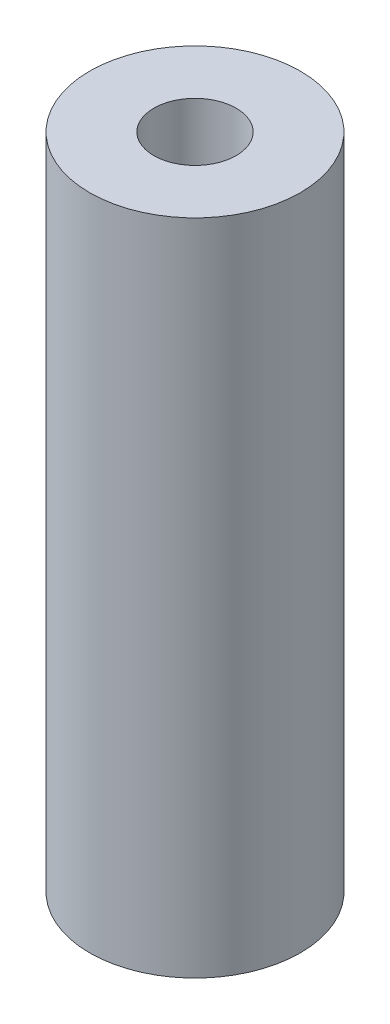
SolidWorks part; units mm, degrees
ref_plane "Front Plane" through (0, 0, 0) normal (0, 0, 1) x (1, 0, 0)
ref_plane "Top Plane" through (0, 0, 0) normal (0, 1, 0) x (1, 0, 0)
ref_plane "Right Plane" through (0, 0, 0) normal (1, 0, 0) x (0, 0, -1)
sketch "Sketch1" plane through (0, 0, 0) normal (0, 1, 0) x (1, 0, 0)
  circle A0 centre (0, 0) radius 4.064
  circle A1 centre (0, 0) radius 1.5875
extrude "Extrude1" add sketch "Sketch1" along normal blind 25.4
